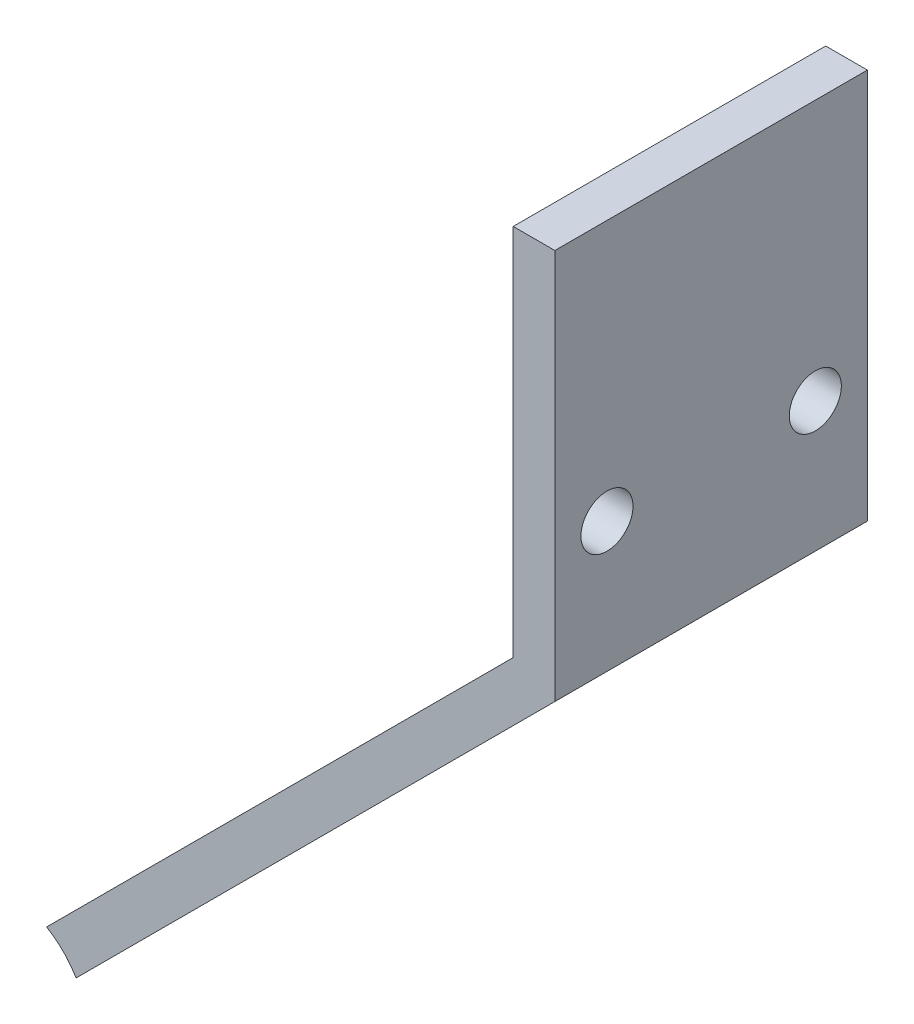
SolidWorks part; units mm, degrees
ref_plane "Plan de face" through (0, 0, 0) normal (0, 0, 1) x (1, 0, 0)
ref_plane "Plan de dessus" through (0, 0, 0) normal (0, 1, 0) x (1, 0, 0)
ref_plane "Plan de droite" through (0, 0, 0) normal (1, 0, 0) x (0, 0, -1)
sketch "Esquisse1" plane through (0, 0, 0) normal (0, 0, 1) x (1, 0, 0)
  line L0 (8, -32.9226) -> (-83.9239, -124.8465)
  line L1 (8, 42.0774) -> (8, -32.9226)
  line L2 (-83.9239, -124.8465) -> (-89.5807, -119.1897)
  line L3 (-89.5807, -119.1897) -> (0, -29.6089)
  line L4 (0, -29.6089) -> (0, 42.0774)
  line L5 (0, 42.0774) -> (8, 42.0774)
  dimension "D1" = 75
  dimension "D2" = 135
  dimension "D3" = 130
  dimension "D4" = 8
  dimension "D5" = 8
extrude "Extrusion1" add sketch "Esquisse1" along normal blind 60
sketch "Esquisse2" plane through (8, 0, 0) normal (1, 0, 0) x (0, 0, -1)
  line L0 (-60, 42.0774) -> (0, 42.0774) construction
  line L1 (-30, 42.0774) -> (-30, -32.9226) construction
  line L2 (-60, -32.9226) -> (0, -32.9226) construction
  circle A0 centre (-50, -7.9226) radius 5
  circle A1 centre (-10, -7.9226) radius 5
  dimension "D1" = 10
  dimension "D2" = 10
  dimension "D3" = 50
  dimension "D4" = 50
  dimension "D5" = 10
  dimension "D6" = 40
extrude "Enlèv. mat.-Extru.1" cut sketch "Esquisse2" against normal through all
sketch "Esquisse4" plane through (0, 0, 0) normal (0, 0, 1) x (1, 0, 0)
  circle A0 centre (-97.7068, -132.9725) radius 16
  dimension "D1" = 32
extrude "Enlèv. mat.-Extru.2" cut sketch "Esquisse4" along normal blind 150
